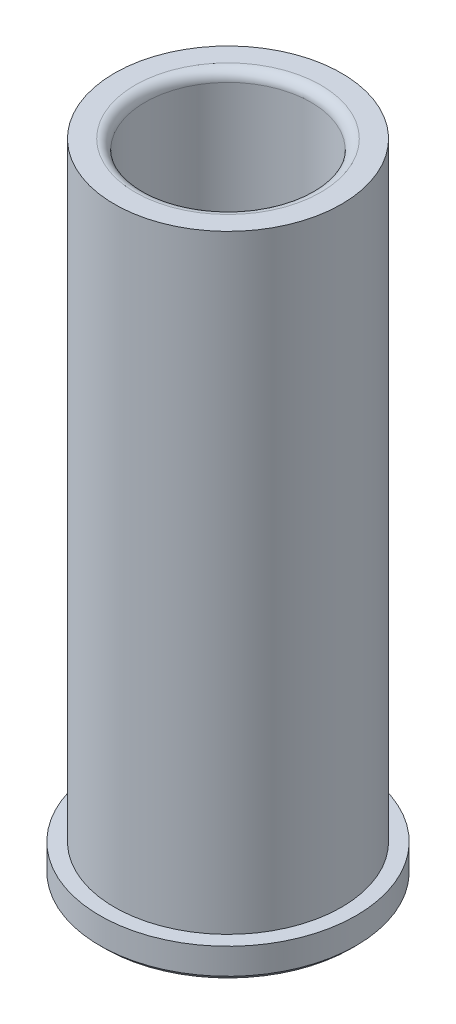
SolidWorks part; units mm, degrees
ref_plane "Front Plane" through (0, 0, 0) normal (0, 0, 1) x (1, 0, 0)
ref_plane "Top Plane" through (0, 0, 0) normal (0, 1, 0) x (1, 0, 0)
ref_plane "Right Plane" through (0, 0, 0) normal (1, 0, 0) x (0, 0, -1)
sketch "Sketch1" plane through (0, 0, 0) normal (0, 0, 1) x (1, 0, 0)
  line L0 (-18.9484, 0) -> (-19.7104, 0.762)
  line L1 (0, -1000) -> (0, 49000) construction
  line L2 (-12.7635, 98.425) -> (-12.7635, 0.762)
  line L3 (-13.5255, 0) -> (-18.9484, 0)
  line L4 (-19.7104, 0.762) -> (-19.7104, 4.7625)
  line L5 (-19.7104, 4.7625) -> (-17.4688, 4.7625)
  line L6 (-17.4688, 98.425) -> (-17.4688, 4.7625)
  line L7 (-17.4688, 98.425) -> (-12.7635, 98.425)
  line L8 (-13.5255, 0) -> (-12.7635, 0.762)
  dimension "OD" = 34.9377
  dimension "ID" = 25.527
  dimension "H" = 39.4208
  dimension "D2" = 45
  dimension "OVERALL LENGTH" = 98.425
  dimension "D4" = 0.762
  dimension "D5" = 135
  dimension "T" = 4.7625
revolve "Revolve1" add sketch "Sketch1" angle 360 about L1
fillet "Fillet1" radius 1.524 1 edges at (12.7635, 98.425, 0)
